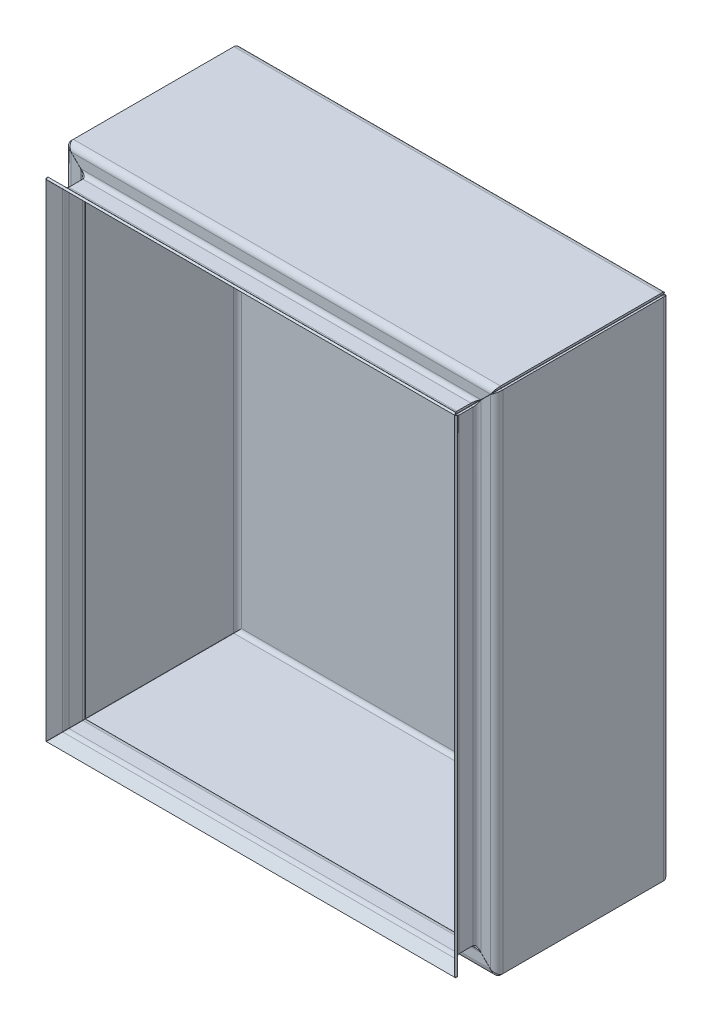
SolidWorks part; units mm, degrees
ref_plane "Front Plane" through (0, 0, 0) normal (0, 0, 1) x (1, 0, 0)
ref_plane "Top Plane" through (0, 0, 0) normal (0, 1, 0) x (1, 0, 0)
ref_plane "Right Plane" through (0, 0, 0) normal (1, 0, 0) x (0, 0, -1)
sketch "Sketch1" plane through (0, 0, 0) normal (0, 0, 1) x (1, 0, 0)
  line L1 (-275, -325) -> (275, -325)
  line L2 (-275, -325) -> (-275, 325)
  line L3 (-275, 325) -> (275, 325)
  line L4 (275, -325) -> (275, 325)
  line L5 (0, 325) -> (0, -325) construction
  line L6 (-275, 0) -> (275, 0) construction
  point P0 (0, 0)
  dimension "D1" = 550
  dimension "D2" = 650
base flange "Base-Flange1" sketch "Sketch1" thickness 2.6568 reverse thickness direction yes parameters "D1"=5.08
ref_plane "Plane1" through (275, 325, 0) normal (-1, 0, 0) x (0, 0, 1)
sketch "Sketch8" plane through (275, 325, 0) normal (-1, 0, 0) x (0, 0, 1)
  line L0 (0, 0) -> (220, 0)
  line L1 (220, 0) -> (220, -25)
  line L2 (220, -25) -> (245, -25)
  line L3 (245, -25) -> (257, -13)
  dimension "D1" = 220
  dimension "D2" = 25
  dimension "D3" = 25
  dimension "D4" = 45
  dimension "D5" = 12
miter flange "Miter Flange1" parameters "D1"=2.54
bend "Miterbend1" bend radius 5.08 bend angle 90 parameters "D5"=1
bend "Miterbend2" bend radius 5.08 bend angle 90 parameters "D5"=2
bend "Miterbend3" bend radius 5.08 bend angle 45 parameters "D5"=3
bend "Miterbend4" bend radius 5.08 bend angle 90 parameters "D5"=4
bend "Miterbend5" bend radius 5.08 bend angle 90 parameters "D5"=5
bend "Miterbend6" bend radius 5.08 bend angle 90 parameters "D5"=6
bend "Miterbend7" bend radius 5.08 bend angle 45 parameters "D5"=7
bend "Miterbend8" bend radius 5.08 bend angle 90 parameters "D5"=8
bend "Miterbend9" bend radius 5.08 bend angle 90 parameters "D5"=9
bend "Miterbend10" bend radius 5.08 bend angle 90 parameters "D5"=10
bend "Miterbend11" bend radius 5.08 bend angle 45 parameters "D5"=11
bend "Miterbend12" bend radius 5.08 bend angle 90 parameters "D5"=12
bend "Miterbend13" bend radius 5.08 bend angle 90 parameters "D5"=13
bend "Miterbend14" bend radius 5.08 bend angle 90 parameters "D5"=14
bend "Miterbend15" bend radius 5.08 bend angle 45 parameters "D5"=15
bend "Miterbend16" bend radius 5.08 bend angle 90 parameters "D5"=16
sketch "Bend-Lines1" [suppressed] plane through (0, 0, 0) normal (0, 1, 0) x (1, 0, 0)
sketch "Bounding-Box1" [suppressed] plane through (0, 0, 0) normal (0, 1, 0) x (1, 0, 0)
sheet metal parameters "Sheet-Metal1" thickness 2.6568 parameters "D1"=2.54
flat pattern "Flat-Pattern1"
sketch "Bend-Lines2" plane through (0, 0, 0) normal (0, 0, -1) x (-1, 0, 0)
  line L0 (-272.2963, 322.1664) -> (-272.2963, -322.1664) construction
  line L1 (-534.504, 298.2994) -> (-534.504, -298.2994) construction
  line L2 (-509.1384, 301.0348) -> (-509.1384, -301.0348) construction
  line L3 (-486.889, 319.6264) -> (-486.889, -319.6264) construction
  line L4 (-272.1664, -322.2963) -> (272.1664, -322.2963) construction
  line L5 (-248.2994, -584.504) -> (248.2994, -584.504) construction
  line L6 (-251.0348, -559.1384) -> (251.0348, -559.1384) construction
  line L7 (-269.6264, -536.889) -> (269.6264, -536.889) construction
  line L8 (272.2963, -322.1664) -> (272.2963, 322.1664) construction
  line L9 (534.504, -298.2994) -> (534.504, 298.2994) construction
  line L10 (509.1384, -301.0348) -> (509.1384, 301.0348) construction
  line L11 (486.889, -319.6264) -> (486.889, 319.6264) construction
  line L12 (272.1664, 322.2963) -> (-272.1664, 322.2963) construction
  line L13 (248.2994, 584.504) -> (-248.2994, 584.504) construction
  line L14 (251.0348, 559.1384) -> (-251.0348, 559.1384) construction
  line L15 (269.6264, 536.889) -> (-269.6264, 536.889) construction
  line L16 (-272.2963, 322.1664) -> (-272.2963, -322.1664) construction
  line L17 (-534.504, 298.2994) -> (-534.504, -298.2994) construction
  line L18 (-509.1384, 301.0348) -> (-509.1384, -301.0348) construction
  line L19 (-486.889, 319.6264) -> (-486.889, -319.6264) construction
  line L20 (-272.1664, -322.2963) -> (272.1664, -322.2963) construction
  line L21 (-248.2994, -584.504) -> (248.2994, -584.504) construction
  line L22 (-251.0348, -559.1384) -> (251.0348, -559.1384) construction
  line L23 (-269.6264, -536.889) -> (269.6264, -536.889) construction
  line L24 (272.2963, -322.1664) -> (272.2963, 322.1664) construction
  line L25 (534.504, -298.2994) -> (534.504, 298.2994) construction
  line L26 (509.1384, -301.0348) -> (509.1384, 301.0348) construction
  line L27 (486.889, -319.6264) -> (486.889, 319.6264) construction
  line L28 (272.1664, 322.2963) -> (-272.1664, 322.2963) construction
  line L29 (248.2994, 584.504) -> (-248.2994, 584.504) construction
  line L30 (251.0348, 559.1384) -> (-251.0348, 559.1384) construction
  line L31 (269.6264, 536.889) -> (-269.6264, 536.889) construction
sketch3d "Bounding-Box2" [suppressed]
  line L0 (-551.8869, 601.8869, 0) -> (-551.8869, -601.8869, 0) construction
  line L1 (551.8869, 601.8869, 0) -> (551.8869, -601.8869, 0) construction
  line L2 (-551.8869, 601.8869, 0) -> (551.8869, 601.8869, 0) construction
  line L3 (-551.8869, -601.8869, 0) -> (551.8869, -601.8869, 0) construction
bend of the flat pattern "Flatten-<Miterbend1>1"
bend of the flat pattern "Flatten-<Miterbend2>1"
bend of the flat pattern "Flatten-<Miterbend3>1"
bend of the flat pattern "Flatten-<Miterbend4>1"
bend of the flat pattern "Flatten-<Miterbend5>1"
bend of the flat pattern "Flatten-<Miterbend6>1"
bend of the flat pattern "Flatten-<Miterbend7>1"
bend of the flat pattern "Flatten-<Miterbend8>1"
bend of the flat pattern "Flatten-<Miterbend9>1"
bend of the flat pattern "Flatten-<Miterbend10>1"
bend of the flat pattern "Flatten-<Miterbend11>1"
bend of the flat pattern "Flatten-<Miterbend12>1"
bend of the flat pattern "Flatten-<Miterbend13>1"
bend of the flat pattern "Flatten-<Miterbend14>1"
bend of the flat pattern "Flatten-<Miterbend15>1"
bend of the flat pattern "Flatten-<Miterbend16>1"
